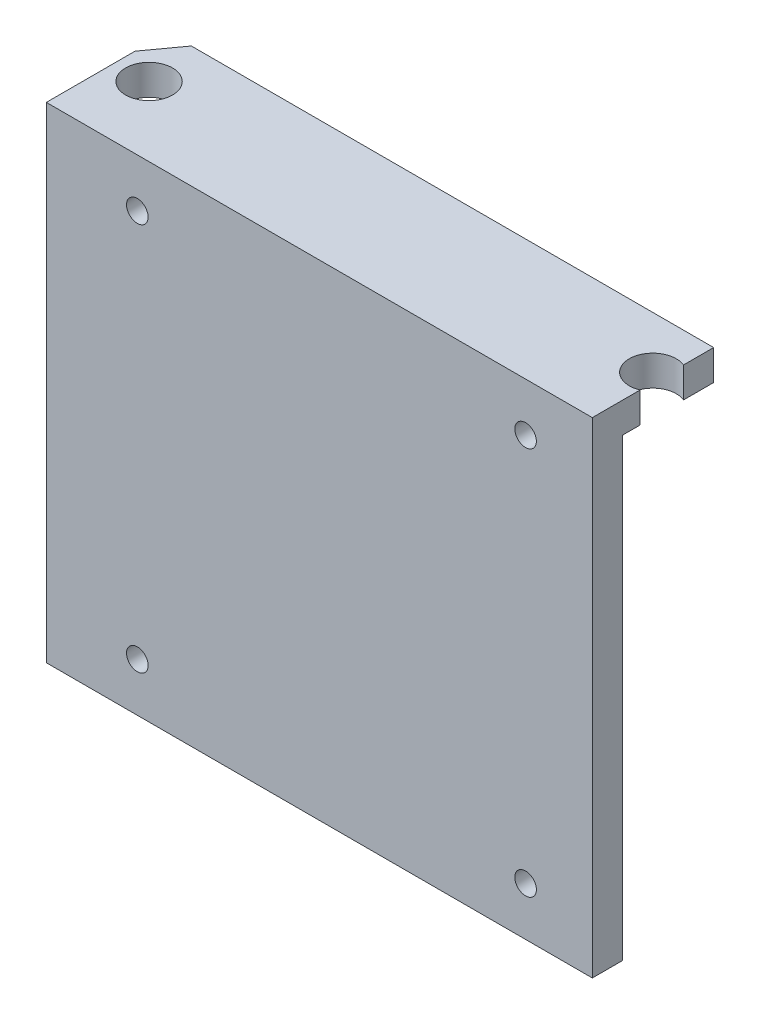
SolidWorks part; units mm, degrees
ref_plane "Front Plane" through (0, 0, 0) normal (0, 0, 1) x (1, 0, 0)
ref_plane "Top Plane" through (0, 0, 0) normal (0, 1, 0) x (1, 0, 0)
ref_plane "Right Plane" through (0, 0, 0) normal (1, 0, 0) x (0, 0, -1)
sketch "Sketch1" plane through (0, 0, 0) normal (1, 0, 0) x (0, 0, -1)
  line L0 (0, 0) -> (0, -50.8)
  line L1 (0, 0) -> (25.4, 0)
  line L2 (25.4, 0) -> (25.4, -3.175)
  line L3 (25.4, -3.175) -> (3.175, -3.175)
  line L4 (3.175, -3.175) -> (3.175, -50.8)
  line L5 (3.175, -50.8) -> (0, -50.8)
  dimension "D1" = 50.8
  dimension "D2" = 25.4
  dimension "D3" = 3.175
  dimension "D4" = 3.175
extrude "Boss-Extrude1" add sketch "Sketch1" along normal mid plane 67.31
hole_wizard "#4-40 Tapped Hole1" positions "Sketch3" profile "Sketch2" tap size "#4-40" standard "ANSI Inch"
sketch "Sketch3" plane through (0, 0, 0) normal (0, 0, 1) x (1, 0, 0)
  line L1 (-20.32, -45.72) -> (20.32, -45.72)
  line L2 (-20.32, -45.72) -> (-20.32, -5.08)
  line L3 (-20.32, -5.08) -> (20.32, -5.08)
  line L4 (20.32, -45.72) -> (20.32, -5.08)
  line L5 (-20.32, -45.72) -> (20.32, -5.08) construction
  line L6 (-20.32, -5.08) -> (20.32, -45.72) construction
  line L7 (-33.655, -25.4) -> (0, -25.4) construction
  line L8 (-33.655, 0) -> (-33.655, -50.8) construction
  point P0 (-20.32, -45.72)
  point P206 (-20.32, -5.08)
  point P209 (20.32, -5.08)
  point P212 (20.32, -45.72)
  dimension "D1" = 40.64
  dimension "D2" = 40.64
sketch "Sketch2" plane through (-20.32, -45.72, 0) normal (1, 0, 0) x (0, -1, 0)
  line L0 (0, 0) -> (0, 25.4)
  line L1 (0, 25.4) -> (1.1303, 25.4)
  line L2 (1.1303, 25.4) -> (1.1303, 0)
  line L5 (1.1303, 0) -> (0, 0)
  line L11 (0, -6.35) -> (0, 107.95) construction
  dimension "Thread Major Dia." = 2.2606
  dimension "Thru Tap Drill Depth" = 25.4
hole_wizard "#10 (0.1935) Diameter Hole1" positions "Sketch4" profile "Sketch5" hole size "#10" standard "ANSI Inch"
sketch "Sketch4" plane through (0, 0, 0) normal (0, 1, 0) x (1, 0, 0)
  line L0 (-26.3622, 7.2709) -> (26.3622, 7.2709) construction
  line L1 (0, 7.2709) -> (0, 0) construction
  circle A0 centre (26.3622, 7.2709) radius 1.7272 construction
  circle A1 centre (-26.3622, 7.2709) radius 2.0828 construction
  point P0 (-26.3622, 7.2709)
  point P2 (26.3622, 7.2709)
sketch "Sketch5" plane through (-26.3622, 0, -7.2709) normal (1, 0, 0) x (0, 0, 1)
  line L0 (0, 0) -> (0, 50.8)
  line L1 (0, 50.8) -> (2.4574, 50.8)
  line L2 (2.4574, 50.8) -> (2.4574, 0)
  line L5 (2.4574, 0) -> (0, 0)
  line L11 (0, -6.35) -> (0, 107.95) construction
  dimension "Thru Hole Dia." = 4.9149
  dimension "Thru Hole Depth" = 50.8
sketch "Sketch6" plane through (0, -3.175, 0) normal (0, -1, 0) x (1, 0, 0)
  line L0 (33.655, -4.0393) -> (27.3626, -12.7)
  line L1 (33.655, -3.175) -> (33.655, -25.4) construction
  line L2 (27.3626, -12.7) -> (-27.3626, -12.7)
  line L3 (-27.3626, -12.7) -> (-33.655, -4.0393)
  line L4 (-33.655, -3.175) -> (-33.655, -25.4) construction
  line L5 (-33.655, -4.0393) -> (-33.655, -25.4)
  line L6 (-33.655, -25.4) -> (33.655, -25.4)
  line L7 (33.655, -25.4) -> (-33.655, -25.4) construction
  line L8 (33.655, -25.4) -> (33.655, -4.0393)
  line L9 (0, 0) -> (0, -25.4) construction
  line L10 (36.9379, -0.8171) -> (26.3631, -15.3721) construction
  line L13 (33.655, 0) -> (-33.655, 0) construction
  dimension "D1" = 0.762
  dimension "D2" = 12.7
extrude "Cut-Extrude1" cut sketch "Sketch6" against normal through all
sketch "Sketch7" plane through (0, 0, 0) normal (0, 0, 1) x (1, 0, 0)
  line L0 (33.655, -50.8) -> (-33.655, -50.8) construction
  line L1 (33.655, 0) -> (27.305, 0)
  line L2 (33.655, 0) -> (33.655, -50.8)
  line L3 (33.655, -50.8) -> (27.305, -50.8)
  line L4 (27.305, 0) -> (27.305, -50.8)
  line L5 (33.655, 0) -> (-33.655, 0) construction
  line L6 (-33.655, -50.8) -> (-29.845, -50.8)
  line L7 (-33.655, -50.8) -> (-33.655, 0)
  line L8 (-33.655, 0) -> (-29.845, 0)
  line L9 (-29.845, -50.8) -> (-29.845, 0)
  dimension "D1" = 6.35
  dimension "D2" = 3.81
extrude "Cut-Extrude2" cut sketch "Sketch7" against normal through all
